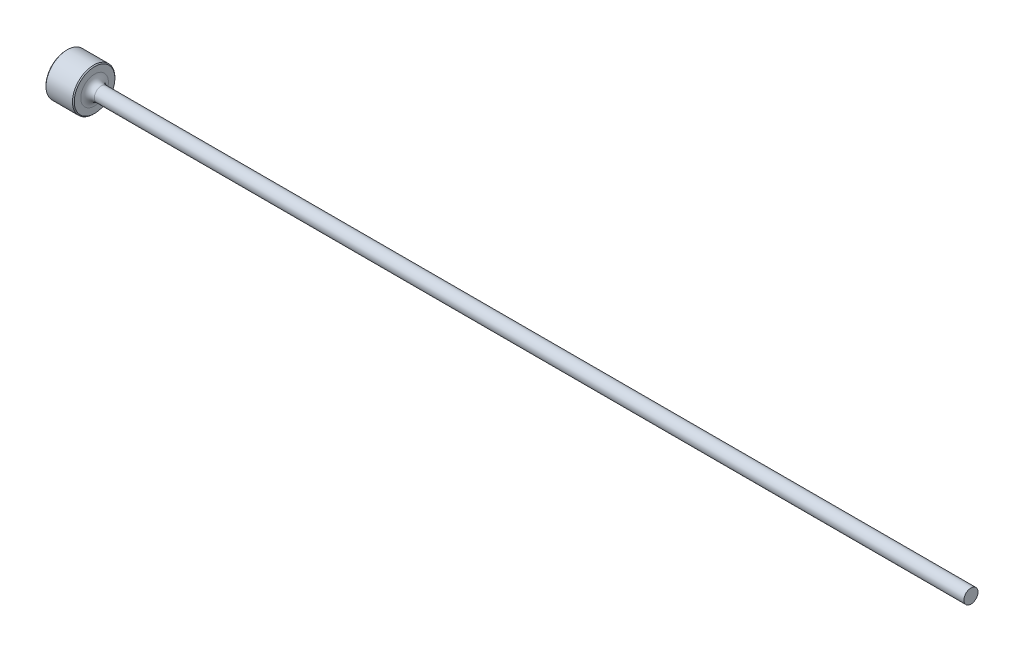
SolidWorks part; units mm, degrees
ref_plane "Front Plane" through (0, 0, 0) normal (0, 0, 1) x (1, 0, 0)
ref_plane "Top Plane" through (0, 0, 0) normal (0, 1, 0) x (1, 0, 0)
ref_plane "Right Plane" through (0, 0, 0) normal (1, 0, 0) x (0, 0, -1)
sketch "Sketch1" plane through (0, 0, 0) normal (0, 0, 1) x (1, 0, 0)
  line L0 (0, 0) -> (0, 2.3812)
  line L1 (0, 2.3812) -> (3.175, 2.3812)
  line L2 (3.175, 2.3812) -> (3.175, 1.5519)
  line L3 (3.937, 0.7899) -> (101.6, 0.7899)
  line L4 (101.6, 0.7899) -> (101.6, 0)
  line L5 (101.6, 0) -> (0, 0)
  line L6 (101.6, 0) -> (101.6, -0.7899) construction
  line L7 (101.6, -0.7899) -> (3.175, -0.7899) construction
  line L8 (0, 0) -> (0, -2.3812) construction
  line L9 (0, -2.3812) -> (3.175, -2.3812) construction
  line L10 (3.175, -2.3812) -> (3.175, -0.7899) construction
  arc A0 (3.175, 1.5519) -> (3.937, 0.7899) centre (3.937, 1.5519) ccw
  dimension "D4" = 0.762
  dimension "L" = 101.6
  dimension "D" = 1.5799
  dimension "H" = 4.7625
  dimension "T" = 3.175
revolve "Revolve1" add sketch "Sketch1" angle 360 about L5
chamfer "Chamfer1" distance 0.1016 angle 45 2 edges at (0, 2.3812, 0) (3.175, 2.3812, 0)
